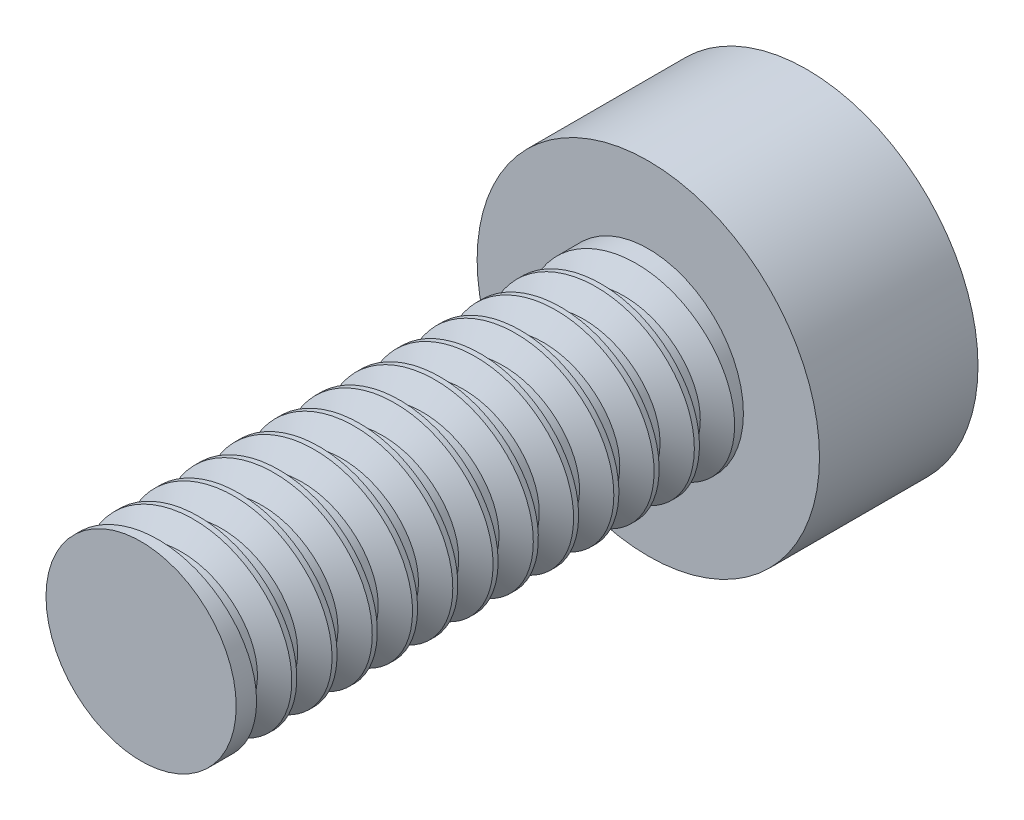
SolidWorks part; units mm, degrees
ref_plane "前视基准面" through (0, 0, 0) normal (0, 0, 1) x (1, 0, 0)
ref_plane "上视基准面" through (0, 0, 0) normal (0, 1, 0) x (1, 0, 0)
ref_plane "右视基准面" through (0, 0, 0) normal (1, 0, 0) x (0, 0, -1)
sketch "草图1" plane through (0, 0, 0) normal (0, 0, 1) x (1, 0, 0)
  circle A0 centre (0, 0) radius 2.7
  dimension "D1" = 5.4
extrude "凸台-拉伸1" add sketch "草图1" along normal blind 2.5
sketch "草图2" plane through (0, 0, 2.5) normal (0, 0, 1) x (1, 0, 0)
  circle A0 centre (0, 0) radius 1.5
  dimension "D1" = 3
extrude "凸台-拉伸2" add sketch "草图2" along normal blind 8
thread "螺纹线1" pitch 0.635 start angle 0, offset 0, length 7.5, pitch 0.635, diameter 3
ref_plane "基准面4" through (-1.5, 0, 10.5) normal (0, -1, 0) x (-1, 0, 0)
sketch "螺纹线轮廓1" plane through (-1.5, 0, 10.5) normal (0, -1, 0) x (-1, 0, 0)
  line L0 (0, 0) -> (0, 0.635) construction
  line L11 (0, 0) -> (0, 0.5556)
  line L12 (0, 0.5556) -> (-0.3437, 0.3572)
  line L13 (-0.3437, 0.3572) -> (-0.3437, 0.1984)
  line L15 (-0.3437, 0.1984) -> (0, 0)
  line L17 (-0.3437, 0.2778) -> (0, 0.2778) construction
  point P2 (0, 0)
  dimension "Pitch" = 0.635
  dimension "Profile_Angle" = 60
  dimension "Profile_Land" = 0.1588
  dimension "Profile_Height" = 0.3437
sketch "草图6" plane through (0, 0, 0) normal (0, 0, -1) x (-1, 0, 0)
  line L1 (1.5433, -0.7863) -> (1.4526, 0.9434)
  line L2 (1.4526, 0.9434) -> (-0.0907, 1.7297)
  line L3 (-0.0907, 1.7297) -> (-1.5433, 0.7863)
  line L4 (-1.5433, 0.7863) -> (-1.4526, -0.9434)
  line L5 (-1.4526, -0.9434) -> (0.0907, -1.7297)
  line L6 (0.0907, -1.7297) -> (1.5433, -0.7863)
  circle A0 centre (0, 0) radius 1.5 construction
  dimension "D1" = 3
extrude "切除-拉伸1" cut sketch "草图6" against normal blind 1
